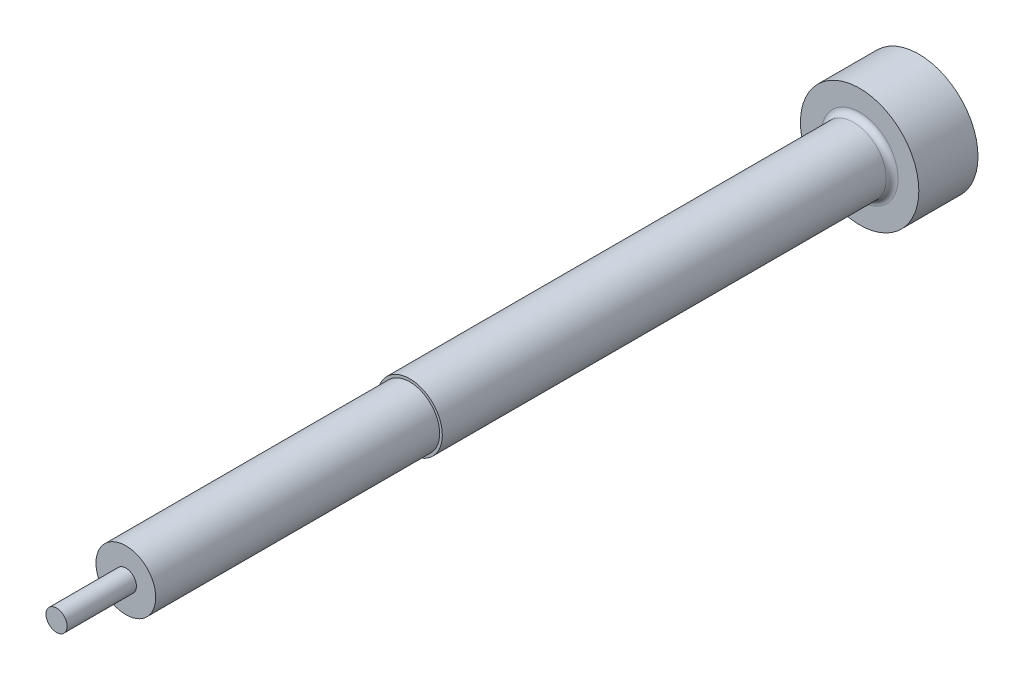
SolidWorks part; units mm, degrees
ref_plane "Face" through (0, 0, 0) normal (0, 0, 1) x (1, 0, 0)
ref_plane "Dessus" through (0, 0, 0) normal (0, 1, 0) x (1, 0, 0)
ref_plane "Droite" through (0, 0, 0) normal (1, 0, 0) x (0, 0, -1)
sketch "Esquisse1" plane through (0, 0, 0) normal (0, 0, 1) x (1, 0, 0)
  circle A0 centre (0, 0) radius 2
  dimension "D1" = 4
extrude "Tête" add sketch "Esquisse1" along normal blind 2
sketch "Esquisse2" plane through (0, 0, 2) normal (0, 0, 1) x (1, 0, 0)
  circle A0 centre (0, 0) radius 1.1
  dimension "D1" = 2.2
extrude "Partie active" add sketch "Esquisse2" along normal offset from surface (98 mm away) 100
fillet "Congé1" radius 0.2 1 edges at (1.1, 0, 2)
sketch "Esquisse3" plane through (0, 0, 100) normal (0, 0, 1) x (1, 0, 0)
  circle A1 centre (0, 0) radius 1.1
  circle A2 centre (0, 0) radius 1.1
  dimension "D1" = 0
extrude "Mise à longueur" cut sketch "Esquisse3" against normal up to surface (70.8648 mm away)
other "Empreinte2"
other "Carter<1>@jeu blocs empreintes droit_Etudiant_Corrigé"
sketch "Esquisse4" plane through (0, 0, 27.2) normal (0, 0, 1) x (1, 0, 0)
  circle A0 centre (0, 0) radius 1.0096 construction
  circle A1 centre (0, 0) radius 1.0096
extrude "Réduction au diam exact" cut sketch "Esquisse4" against normal offset from surface (10 mm away) 10 flip side to cut
